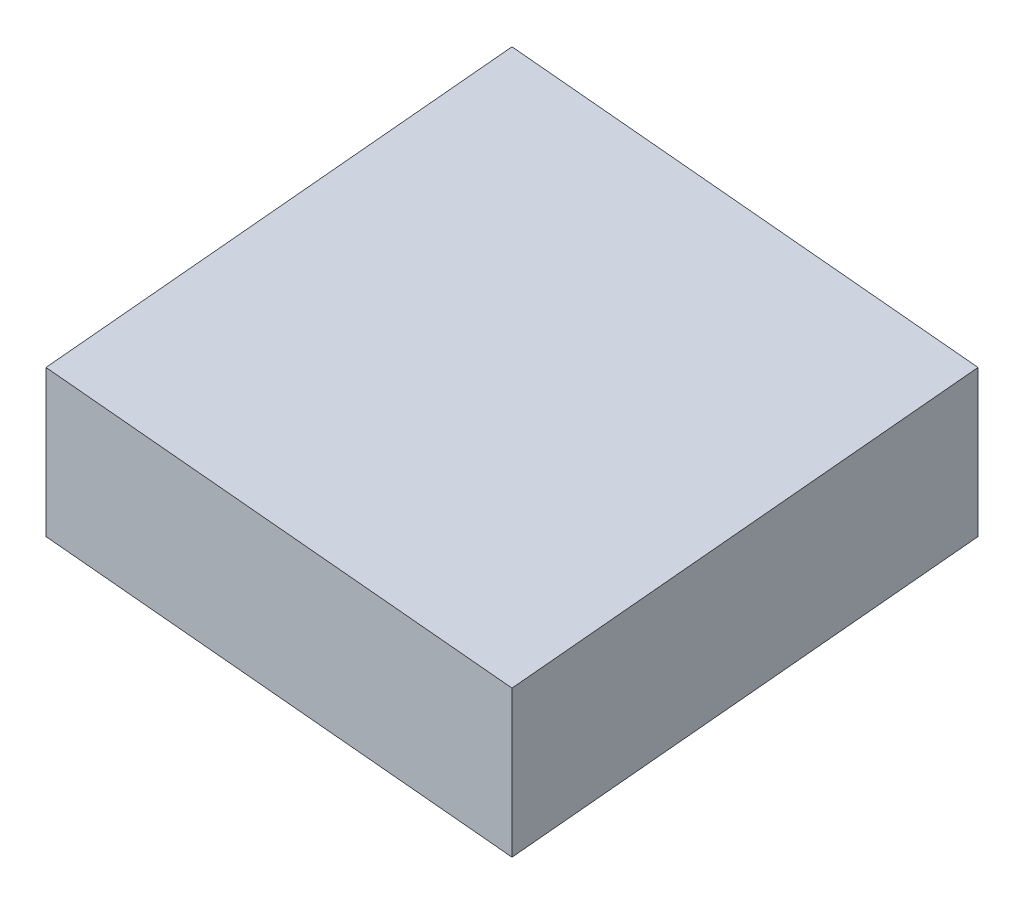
SolidWorks part; units mm, degrees
ref_plane "Face" through (0, 0, 0) normal (0, 0, 1) x (1, 0, 0)
ref_plane "Dessus" through (0, 0, 0) normal (0, 1, 0) x (1, 0, 0)
ref_plane "Droite" through (0, 0, 0) normal (1, 0, 0) x (0, 0, -1)
sketch "EsqCorps" plane through (0, 0, 0) normal (0, 1, 0) x (1, 0, 0)
  circle A0 centre (0, 0) radius 0.0005
  dimension "Dcorps" = 0.001
extrude "Corps" add sketch "EsqCorps" against normal mid plane 0.001
sketch "EsqC" plane through (0, 0, 0) normal (0, 1, 0) x (1, 0, 0)
  line L0 (-0.001, -0.0001) -> (0.7833, -8.9648)
  line L1 (0.7842, -8.9658) -> (9.749, -9.7501)
  line L2 (9.7501, -9.749) -> (8.9658, -0.7842)
  line L3 (8.9648, -0.7833) -> (0.0001, 0.001)
  line L4 (0.0001, 0.001) -> (0.0001, 0.101) construction
  arc A0 (0.0001, 0.001) -> (-0.001, -0.0001) centre (0, 0) ccw
  arc A1 (8.9658, -0.7842) -> (8.9648, -0.7833) centre (8.9648, -0.7843) ccw
  arc A2 (9.749, -9.7501) -> (9.7501, -9.749) centre (9.7491, -9.7491) ccw
  arc A3 (0.7833, -8.9648) -> (0.7842, -8.9658) centre (0.7843, -8.9648) ccw
  dimension "RayonBec" = 0.001
  dimension "Kr" = 95
  dimension "AnglePlaquette" = 80
  dimension "DimPlaquette" = 8.999
extrude "PlaquetteC" add sketch "EsqC" against normal blind 2.5714
sketch "EsqT" [suppressed] plane through (0, 0, 0) normal (0, 1, 0) x (1, 0, 0)
  line L0 (0.2, -0.3464) -> (-9.4995, -5.9464)
  line L1 (-10.0995, -5.6) -> (-10.0995, 5.6)
  line L2 (-9.4995, 5.9464) -> (0.2, 0.3464)
  line L3 (0.2, -0.3464) -> (0.2, -0.2464) construction
  arc A0 (0.2, -0.3464) -> (0.2, 0.3464) centre (0, 0) ccw
  arc A1 (-10.0995, -5.6) -> (-9.4995, -5.9464) centre (-9.6995, -5.6) ccw
  arc A2 (-9.4995, 5.9464) -> (-10.0995, 5.6) centre (-9.6995, 5.6) ccw
  dimension "RayonBec" = 1
  dimension "Kr" = 95
  dimension "AnglePlaquette" = 60
  dimension "D4" = 60
  dimension "DimPlaquette" = 8
extrude "PlaquetteT" [suppressed] add sketch "EsqT" against normal blind 4
sketch "EsqW" plane through (0, 0, 0) normal (0, 1, 0) x (1, 0, 0)
  line L0 (0.0872, 0.9962) -> (6.0643, 0.4733)
  line L1 (6.0643, 0.4733) -> (11.5022, -2.0624)
  line L2 (11.8987, -3.5423) -> (8.4572, -8.4572)
  line L3 (8.4572, -8.4572) -> (3.5423, -11.8987)
  line L4 (2.0624, -11.5022) -> (-0.4733, -6.0643)
  line L5 (-0.4733, -6.0643) -> (-0.9962, -0.0872)
  line L6 (0.0872, 0.9962) -> (0.0872, 1.0962) construction
  arc A0 (0.0872, 0.9962) -> (-0.9962, -0.0872) centre (0, 0) ccw
  arc A1 (3.5423, -11.8987) -> (2.0624, -11.5022) centre (2.9688, -11.0796) cw
  arc A2 (11.5022, -2.0624) -> (11.8987, -3.5423) centre (11.0796, -2.9688) cw
  dimension "RayonBec" = 1
  dimension "AnglePlaquette" = 80
  dimension "D2" = 80
  dimension "D3" = 80
  dimension "D4" = 160
  dimension "D5" = 160
  dimension "DimPlaquette" = 6
  dimension "Kr" = 95
extrude "PlaquetteW" [suppressed] add sketch "EsqW" along normal blind 4
sketch "EsqR" [suppressed] plane through (0, 0, 0) normal (0, 1, 0) x (1, 0, 0)
  circle A0 centre (0, 0) radius 6
  dimension "Diametre" = 12
extrude "PlaquetteR" [suppressed] add sketch "EsqR" against normal blind 4
sketch "EsqK" [suppressed] plane through (0, 0, 0) normal (0, 1, 0) x (1, 0, 0)
  line L0 (0.0872, 0.9962) -> (1.0834, 0.909)
  line L1 (-0.866, -0.5) -> (0.134, -2.2321)
  line L2 (1.8622, 0.4128) -> (2.8622, -1.3192)
  line L3 (1.909, -2.8154) -> (0.9128, -2.7282)
  line L4 (0.0872, 0.9962) -> (0.0872, 1.0962) construction
  arc A0 (0.0872, 0.9962) -> (-0.866, -0.5) centre (0, 0) ccw
  arc A1 (1.8622, 0.4128) -> (1.0834, 0.909) centre (0.9962, -0.0872) ccw
  arc A2 (1.909, -2.8154) -> (2.8622, -1.3192) centre (1.9962, -1.8192) ccw
  arc A3 (0.134, -2.2321) -> (0.9128, -2.7282) centre (1, -1.7321) ccw
  dimension "RayonBec" = 1
  dimension "Kr" = 95
  dimension "DimPlaquette1" = 0
  dimension "AnglePlaquette" = 55
  dimension "DimPlaquette2" = 0
extrude "PlaquetteK" [suppressed] add sketch "EsqK" against normal blind 4
sketch "EsqGR" [suppressed] plane through (0, 0, 0) normal (0, 1, 0) x (1, 0, 0)
  line L0 (1.4283, 1.4) -> (6, 1.4)
  line L1 (6, 1.4) -> (6, -1.4)
  line L2 (6, -1.4) -> (1.4283, -1.4)
  line L3 (1.4283, 1.4) -> (1.4283, 1.5) construction
  arc A0 (1.4283, 1.4) -> (1.4283, -1.4) centre (0, 0) ccw
  dimension "RayonBec" = 2
  dimension "Largeur" = 2.8
  dimension "Longueur" = 6
  dimension "Kr" = 90
extrude "PlaquetteGR" [suppressed] add sketch "EsqGR" against normal blind 4
sketch "EsqGP" plane through (0, 0, 0) normal (0, 1, 0) x (1, 0, 0)
  line L0 (0.1008, 0.9949) -> (4, 0.6)
  line L1 (4, 0.6) -> (9, 0.6)
  line L2 (9, 0.6) -> (9, -2.6)
  line L3 (9, -2.6) -> (4, -2.6)
  line L4 (4, -2.6) -> (0.1008, -2.9949)
  line L5 (-1, -2) -> (-1, 0)
  line L6 (4, 0.6) -> (4, 0.7) construction
  arc A0 (-1, 0) -> (0.1008, 0.9949) centre (0, 0) cw
  arc A1 (0.1008, -2.9949) -> (-1, -2) centre (0, -2) cw
  dimension "RayonBec" = 1
  dimension "RayonBec2" = 1
  dimension "Largeur" = 3.2
  dimension "Longueur" = 10
  dimension "LongCorps" = 5
  dimension "DimPlaquette" = 2
  dimension "PosCorps" = 2.6
  dimension "Kr" = 90
extrude "PlaquetteGP" [suppressed] add sketch "EsqGP" against normal blind 4
sketch "EsqGFT1" [suppressed] plane through (0, 0, 0) normal (0, 1, 0) x (1, 0, 0)
  line L0 (-0.0436, 0.4981) -> (1.7102, 0.6515)
  line L1 (2.1667, 1.1496) -> (2.1667, 1.4582)
  line L2 (2.1667, 1.4582) -> (10.6667, 1.4582)
  line L3 (10.6667, 1.4582) -> (14.1667, -2.0418)
  line L4 (14.1667, -2.0418) -> (14.1667, -5.6504)
  line L5 (14.6231, -6.1485) -> (16.3769, -6.3019)
  line L6 (16.8333, -6.8) -> (16.8333, -9.0837)
  line L7 (16.3769, -9.5818) -> (14.6231, -9.7352)
  line L8 (14.1667, -10.2333) -> (14.1667, -10.5418)
  line L9 (14.1667, -10.5418) -> (5.6667, -10.5418)
  line L10 (5.6667, -10.5418) -> (2.1667, -7.0418)
  line L11 (2.1667, -7.0418) -> (2.1667, -3.4333)
  line L12 (1.7102, -2.9352) -> (-0.0436, -2.7818)
  line L13 (-0.5, -2.2837) -> (-0.5, 0)
  line L14 (2.1667, 1.4582) -> (2.1667, 6.5976) construction
  circle A0 centre (8.1667, -4.5418) radius 2
  arc A1 (-0.0436, 0.4981) -> (-0.5, 0) centre (0, 0) ccw
  arc A2 (2.1667, 1.1496) -> (1.7102, 0.6515) centre (1.6667, 1.1496) cw
  arc A3 (-0.0436, -2.7818) -> (-0.5, -2.2837) centre (0, -2.2837) cw
  arc A4 (2.1667, -3.4333) -> (1.7102, -2.9352) centre (1.6667, -3.4333) ccw
  arc A5 (14.6231, -6.1485) -> (14.1667, -5.6504) centre (14.6667, -5.6504) cw
  arc A6 (16.8333, -6.8) -> (16.3769, -6.3019) centre (16.3333, -6.8) ccw
  arc A7 (16.3769, -9.5818) -> (16.8333, -9.0837) centre (16.3333, -9.0837) ccw
  arc A8 (14.1667, -10.2333) -> (14.6231, -9.7352) centre (14.6667, -10.2333) cw
  point P18 (-0.5, 0.4582)
  point P21 (2.1667, 0.6915)
  point P24 (-0.5, -2.7418)
  dimension "D1" = 95
  dimension "D11" = 4
  dimension "D12" = 6
  dimension "D13" = 6
  dimension "RayonBec" = 0.5
  dimension "D2" = 95
  dimension "D3" = 3.5
  dimension "Hauteur" = 2.6667
  dimension "DimPlaquette" = 3.2
  dimension "Position" = 1
  dimension "D6" = 135
  dimension "D7" = 12
  dimension "D8" = 12
  dimension "D9" = 135
  dimension "Kr" = 90
extrude "PlaquetteGFT1" [suppressed] add sketch "EsqGFT1" against normal blind 4.76
sketch "EsqFI1" plane through (0, 0, 0) normal (0, 1, 0) x (1, 0, 0)
  line L0 (0, 0) -> (1.5, 0.866)
  line L1 (1.5, 0.866) -> (7.5386, 0.866)
  line L2 (0, 0) -> (1.5, -0.866)
  line L3 (1.5, -0.866) -> (1.5, -5.1726)
  line L4 (1.5, -5.1726) -> (4.5193, -10.4022)
  line L5 (9.7489, -7.3829) -> (12.7682, -2.1533)
  line L6 (7.5386, 0.866) -> (11.2682, -1.2873)
  line L7 (12.7682, -0.4212) -> (11.2682, -1.2873)
  line L8 (12.7682, -0.4212) -> (12.7682, -2.1533)
  line L9 (11.2682, -1.2873) -> (7.5386, 0.866)
  line L10 (6.0193, -11.2682) -> (6.0193, -9.5361)
  line L11 (6.0193, -11.2682) -> (4.5193, -10.4022)
  line L12 (6.0193, -9.5361) -> (9.7489, -7.3829)
  line L13 (6.0193, -9.5361) -> (9.7489, -7.3829)
  line L14 (1.5, 0.866) -> (1.5, 4.3142) construction
  circle A0 centre (6.2625, -3.8965) radius 4.7625 construction
  circle A1 centre (6.2625, -3.8965) radius 1.9
  dimension "D6" = 60
  dimension "D11" = 3.8
  dimension "D7" = 9.525
  dimension "D1" = 60
  dimension "D2" = 1.5
  dimension "D4" = 150
  dimension "D5" = 60
  dimension "D9" = 150
  dimension "D10" = 150
  dimension "Kr" = 90
extrude "PlaquetteFI1" [suppressed] add sketch "EsqFI1" against normal blind 3.65
sketch "EsqGFCL" plane through (0, 0, 0) normal (0, 0, 1) x (1, 0, 0)
  line L0 (7.1798, -13.6703) -> (8.4782, -12.6558)
  line L1 (2.5, 0) -> (13.9009, 0)
  line L2 (14.1787, -2.7823) -> (8.4782, -12.6558)
  line L3 (5.9295, -11.5047) -> (0.2293, -1.6317)
  line L4 (0, 0) -> (0.2293, -1.6317)
  line L5 (15.4287, -0.6172) -> (13.9009, 0)
  line L6 (7.183, -13.6677) -> (8.4782, -12.6558)
  line L7 (0, 0) -> (0, 5.2766) construction
  line L9 (0, 0) -> (0, 0.0005) construction
  circle A0 centre (7.5362, -4.7625) radius 4.7625 construction
  circle A1 centre (7.5362, -4.7625) radius 2.25
  arc A2 (2.5, 0) -> (0, 0) centre (1.25, 2.1651) cw
  arc A3 (14.1787, -2.7823) -> (15.4287, -0.6172) centre (16.6787, -2.7823) cw
  arc A4 (7.183, -13.6677) -> (5.9295, -11.5047) centre (4.683, -13.6718) ccw
  arc A5 (5.9298, -11.5052) -> (7.1798, -13.6703) centre (4.6798, -13.6703) cw
  dimension "D1" = 60
  dimension "D3" = 9.525
  dimension "D4" = 4.5
  dimension "D8" = 2.5
  dimension "D11" = 2.5
  dimension "D10" = 2.5
  dimension "D2" = 60
  dimension "D5" = 6.8
  dimension "D6" = 158
  dimension "D7" = 2.5
  dimension "D9" = 158
  dimension "D12" = 6.8
  dimension "Kr" = 90
extrude "PlaquetteGFCL" [suppressed] add sketch "EsqGFCL" along normal blind 1.85
sketch "EsqGFCR" plane through (0, 0, 0) normal (0, 0, 1) x (1, 0, 0)
  line L0 (0, 0) -> (0, -6.7061) construction
  line L1 (14.1787, 2.7823) -> (8.4782, 12.6558)
  line L2 (5.9298, 11.5052) -> (0.2293, 1.6317)
  line L3 (0, 0) -> (0.2293, 1.6317)
  line L4 (15.4287, 0.6172) -> (13.9009, 0)
  line L5 (7.1798, 13.6703) -> (8.4782, 12.6558)
  line L6 (2.5, 0) -> (13.9009, 0)
  line L7 (0, 0) -> (0, 0.0005) construction
  circle A0 centre (7.5362, 4.7625) radius 4.7625 construction
  circle A1 centre (7.5362, 4.7625) radius 2.25
  arc A2 (2.5, 0) -> (0, 0) centre (1.25, -2.1651) ccw
  arc A3 (15.4287, 0.6172) -> (14.1787, 2.7823) centre (16.6787, 2.7823) cw
  arc A4 (7.1798, 13.6703) -> (5.9298, 11.5052) centre (4.6798, 13.6703) cw
  dimension "D1" = 9.525
  dimension "D4" = 4.5
  dimension "D8" = 2.5
  dimension "D12" = 2.5
  dimension "D14" = 2.5
  dimension "D5" = 158
  dimension "D6" = 6.8
  dimension "D7" = 2.5
  dimension "D9" = 158
  dimension "D11" = 2.5
  dimension "D13" = 2.5
  dimension "D15" = 6.8
  dimension "D16" = 6.8
  dimension "Kr" = 90
extrude "PlaquetteGFCR" [suppressed] add sketch "EsqGFCR" along normal blind 1.8
sketch "EsqGFT2" [suppressed] plane through (0, 0, 0) normal (0, 1, 0) x (1, 0, 0)
  line L0 (2.0833, -1.6842) -> (2.0833, 15.4983) construction
  line L14 (-0.5, 2.1837) -> (-0.5, 0)
  line L16 (1.6269, 2.8279) -> (-0.0436, 2.6818)
  line L17 (2.0833, 6.8158) -> (2.0833, 3.326)
  line L18 (5.5833, 10.3158) -> (2.0833, 6.8158)
  line L19 (14.0833, 10.3158) -> (5.5833, 10.3158)
  line L20 (14.0833, 9.774) -> (14.0833, 10.3158)
  line L21 (16.2102, 9.1297) -> (14.5398, 9.2759)
  line L22 (16.6667, 6.448) -> (16.6667, 8.6316)
  line L23 (14.5398, 5.8037) -> (16.2102, 5.9499)
  line L24 (14.0833, 1.8158) -> (14.0833, 5.3056)
  line L25 (10.5833, -1.6842) -> (14.0833, 1.8158)
  line L26 (2.0833, -1.6842) -> (10.5833, -1.6842)
  line L27 (2.0833, -1.1423) -> (2.0833, -1.6842)
  line L28 (-0.0436, -0.4981) -> (1.6269, -0.6442)
  arc A0 (2.0833, 3.326) -> (1.6269, 2.8279) centre (1.5833, 3.326) cw
  arc A1 (-0.5, 2.1837) -> (-0.0436, 2.6818) centre (0, 2.1837) cw
  arc A2 (-0.0436, -0.4981) -> (-0.5, 0) centre (0, 0) cw
  arc A3 (2.0833, -1.1423) -> (1.6269, -0.6442) centre (1.5833, -1.1423) ccw
  arc A4 (14.5398, 5.8037) -> (14.0833, 5.3056) centre (14.5833, 5.3056) ccw
  arc A5 (16.6667, 6.448) -> (16.2102, 5.9499) centre (16.1667, 6.448) cw
  arc A6 (16.6667, 8.6316) -> (16.2102, 9.1297) centre (16.1667, 8.6316) ccw
  arc A7 (14.5398, 9.2759) -> (14.0833, 9.774) centre (14.5833, 9.774) cw
  circle A17 centre (8.0833, 4.3158) radius 2
  point P5 (-0.5, 2.6418)
  point P9 (-0.5, -0.4582)
  point P13 (2.0833, -0.6842)
  point P26 (14.0833, 9.3158)
  dimension "D9" = 4
  dimension "RayonBec" = 0.5
  dimension "D1" = 12
  dimension "D2" = 12
  dimension "D3" = 135
  dimension "D4" = 135
  dimension "D5" = 3.5
  dimension "D6" = 3.5
  dimension "D7" = 6
  dimension "D8" = 6
  dimension "D10" = 95
  dimension "D11" = 95
  dimension "D12" = 1
  dimension "D13" = 95
  dimension "DimPlaquette" = 3.1
  dimension "D14" = 95
  dimension "D15" = 1
  dimension "Hauteur" = 2.5833
  dimension "Kr" = 90
extrude "PlaquetteGFT2" [suppressed] add sketch "EsqGFT2" along normal blind 4.76
sketch "EsqFI2" plane through (0, 0, 0) normal (0, 1, 0) x (1, 0, 0)
  line L0 (2.5, -1.4434) -> (2.5, 14.2883) construction
  line L1 (10.7489, 6.8055) -> (8.0193, 8.3814)
  line L2 (8.0193, 8.3814) -> (8.0193, 11.2682)
  line L3 (8.0193, 11.2682) -> (5.5193, 9.8248)
  line L4 (8.5386, -1.4434) -> (11.2682, 0.1326)
  line L5 (11.2682, 0.1326) -> (13.7682, -1.3108)
  line L22 (13.7682, -1.3108) -> (13.7682, 1.5759)
  line L25 (10.7489, 6.8055) -> (13.7682, 1.5759)
  line L26 (2.5, 4.5952) -> (5.5193, 9.8248)
  line L27 (2.5, 1.4434) -> (2.5, 4.5952)
  line L28 (0, 0) -> (2.5, 1.4434)
  line L29 (2.5, -1.4434) -> (8.5386, -1.4434)
  line L30 (0, 0) -> (2.5, -1.4434)
  circle A2 centre (7.2625, 3.3191) radius 4.7625 construction
  circle A3 centre (7.2625, 3.3191) radius 1.9
  dimension "D11" = 9.525
  dimension "D12" = 3.8
  dimension "D1" = 60
  dimension "D2" = 60
  dimension "D3" = 60
  dimension "D4" = 60
  dimension "D5" = 60
  dimension "D6" = 150
  dimension "D7" = 150
  dimension "D8" = 150
  dimension "D9" = 2.5
  dimension "Kr" = 90
extrude "PlaquetteFI2" [suppressed] add sketch "EsqFI2" along normal blind 3.65
equation "\"Largeur@EsqGR\" = 1.4 * \"RayonBec@EsqGR\""
equation "\"Longueur@EsqGR\" = 3 * \"RayonBec@EsqGR\""
equation "\"Largeur@EsqGP\" =  ( \"DimPlaquette@EsqGP\" + 2 * \"RayonBec@EsqGP\" )  * 0.8"
equation "\"Longueur@EsqGP\" = 2.5 *  ( \"DimPlaquette@EsqGP\" + 2 * \"RayonBec@EsqGP\" ) "
equation "\"PosCorps@EsqGP\" = \"DimPlaquette@EsqGP\" + \"RayonBec@EsqGP\" - (\"DimPlaquette@EsqGP\" + \"RayonBec@EsqGP\"*2) * 0.1"
equation "\"RayonBec2@EsqGP\" = \"RayonBec@EsqGP\""
equation "\"DimPlaquette2@EsqK\" = \"DimPlaquette1@EsqK\"/2"
equation "\"DimPlaquette1@EsqK\" = \"DimPlaquette2@EsqK\" /2"
equation "\"Hauteur@EsqGFT1\" = \"DimPlaquette@EsqGFT1\" / 1.2"
equation "\"Hauteur@EsqGFT2\" = \"DimPlaquette@EsqGFT2\" / 1.2"
equation "\"LongCorps@EsqGP\" = \"Longueur@EsqGP\" / 2"
